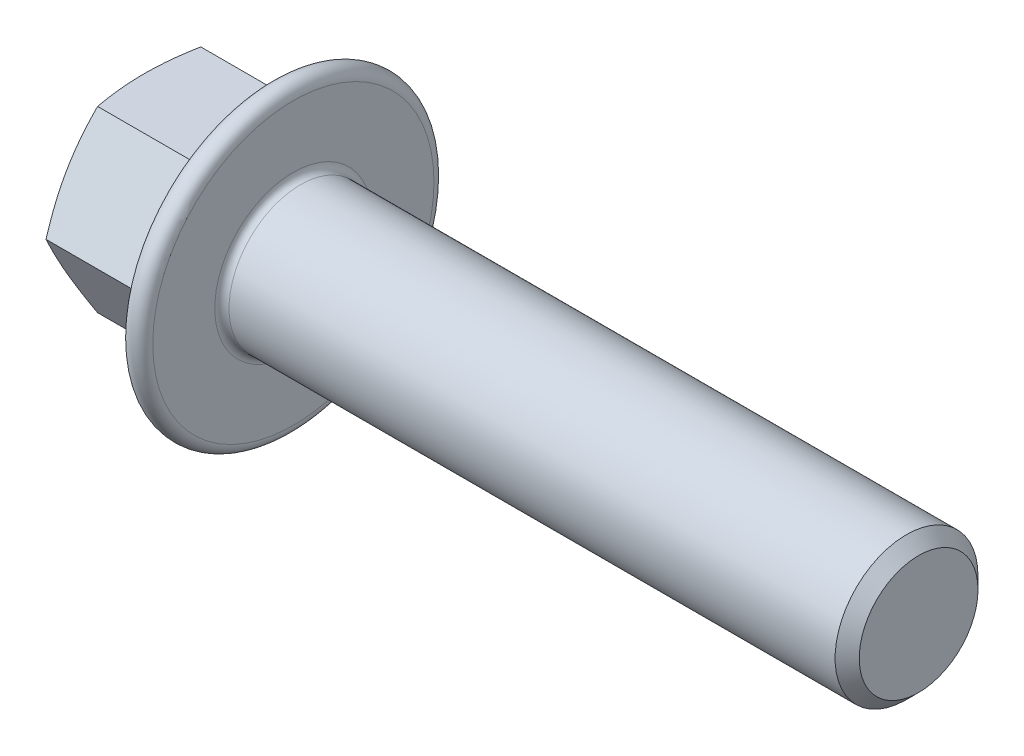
SolidWorks part; units mm, degrees
ref_plane "Front" through (0, 0, 0) normal (0, 0, 1) x (1, 0, 0)
ref_plane "Top" through (0, 0, 0) normal (0, 1, 0) x (1, 0, 0)
ref_plane "Right" through (0, 0, 0) normal (1, 0, 0) x (0, 0, -1)
sketch "Sketch1" plane through (0, 0, 0) normal (1, 0, 0) x (0, 0, -1)
  line L1 (2.8868, -5) -> (5.7735, 0)
  line L2 (5.7735, 0) -> (2.8868, 5)
  line L3 (2.8868, 5) -> (-2.8868, 5)
  line L4 (-2.8868, 5) -> (-5.7735, 0)
  line L5 (-5.7735, 0) -> (-2.8868, -5)
  line L6 (-2.8868, -5) -> (2.8868, -5)
  circle A0 centre (0, 0) radius 5 construction
  dimension "s" = 10
extrude "BaseHead" add sketch "Sketch1" along normal blind 8.5
ref_plane "Plane1" through (21.5, 0, 0) normal (1, 0, 0) x (0, 0, -1)
sketch "Sketch2" plane through (8.5, 0, 0) normal (1, 0, 0) x (0, 0, -1)
  circle A0 centre (0, 0) radius 4
  dimension "d" = 8
extrude "BaseBody" add sketch "Sketch2" along normal blind 35
sketch "Sketch3" plane through (2.5556, 0, 2.0632) normal (0, 1, 0) x (0, 0, -1)
  line L0 (7.8367, 2.5556) -> (7.8367, 2.1285)
  line L2 (7.8367, 2.1285) -> (6.6632, 2.5556)
  line L4 (6.6632, 2.5556) -> (7.8367, 2.5556)
  line L5 (2.0632, 3.5448) -> (2.0632, 2.0587) construction
  dimension "D1" = 20
  dimension "da" = 9.2
revolve "HeadChamfer" cut sketch "Sketch3" angle 360 about L5
sketch "Sketch5" plane through (-3.1384, 0, 9.9384) normal (0, 1, 0) x (0, 0, -1)
  line L0 (9.9384, -11.6384) -> (9.9384, -13.5308) construction
  line L1 (15.7119, -11.6384) -> (12.8252, -11.6384) construction
  line L2 (9.9384, -11.6384) -> (17.8089, -11.6384)
  line L3 (18.075, -10.4384) -> (9.9384, -6.6443)
  line L4 (9.9384, -6.6443) -> (9.9384, -11.6384)
  line L5 (9.9384, -46.6384) -> (9.9384, -11.6384) construction
  arc A0 (17.8089, -11.6384) -> (18.075, -10.4384) centre (17.8089, -11.0089) ccw
  dimension "D3" = 25
  dimension "c" = 1.2
  dimension "dc" = 17
revolve "Revolve1" add sketch "Sketch5" angle 360 about L0
fillet "HeadFillet" radius 0.4 1 edges at (8.5, 0, -4)
fillet "FlangeHexFillet" radius 0.5 6 edges at (5.9201, -1.3369, -5.0017) (5.9201, 3.6631, -3.6586) (5.9201, -3.6631, 3.6586) (5.9201, 1.3369, 5.0017)
chamfer "Chamfer1" distance 0.6765 angle 45 1 edges at (43.5, 0, -4)
equation "\"b@ThreadCosmetic1\" = \"l@BaseBody\" - \"lg@Plane1\""
equation "\"D1@Chamfer1\" = (  \"d@Sketch2\" - \"D2@ThreadCosmetic1\" )  / 2"
